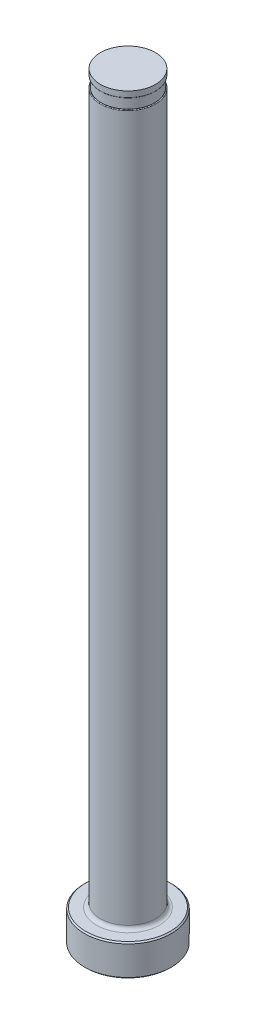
SolidWorks part; units mm, degrees
ref_plane "Front Plane" through (0, 0, 0) normal (0, 0, 1) x (1, 0, 0)
ref_plane "Top Plane" through (0, 0, 0) normal (0, 1, 0) x (1, 0, 0)
ref_plane "Right Plane" through (0, 0, 0) normal (1, 0, 0) x (0, 0, -1)
other "Configuration Table"
sketch "Sketch1" plane through (0, 0, 0) normal (0, 0, 1) x (1, 0, 0)
  line L0 (0, 259.9588) -> (0, -15.1925) construction
  line L1 (0, 0) -> (-8.7249, 0)
  line L2 (-8.7249, 0) -> (-8.7249, 6.35)
  line L3 (-8.7249, 6.35) -> (-5.5562, 6.35)
  line L4 (-5.5562, 6.35) -> (-5.5562, 152.4)
  line L5 (-5.5562, 152.4) -> (0, 152.4)
  line L6 (0, 152.4) -> (0, 0)
  dimension "L" = 152.4
  dimension "H" = 17.4498
  dimension "T" = 6.35
  dimension "D" = 11.1125
revolve "Revolve1" add sketch "Sketch1" angle 360 about L0
chamfer "Chamfer1" distance 0.254 angle 45 2 edges at (0, 6.35, 8.7249) (0, 0, 8.7249)
fillet "Fillet1" radius 0.762 1 edges at (0, 6.35, 5.5562)
sketch "Sketch2" plane through (0, 0, 0) normal (0, 0, 1) x (1, 0, 0)
  line L0 (-5.5562, 152.4) -> (-5.5562, 7.112) construction
  line L1 (-5.5562, 151.13) -> (-5.353, 151.13)
  line L2 (-5.5562, 151.13) -> (-5.5562, 149.098)
  line L3 (-5.5562, 149.098) -> (-5.353, 149.098)
  line L4 (-5.353, 151.13) -> (-5.353, 149.098)
  line L5 (5.5562, 152.4) -> (-5.5562, 152.4) construction
  line L6 (0, 153.4483) -> (0, 147.3282) construction
  dimension "D1" = 2.032
  dimension "N" = 1.27
  dimension "FD" = 0.2032
  dimension "D3" = 10.7061
revolve "Vent Relief" cut sketch "Sketch2" angle 360 about L6
sketch "Sketch3" plane through (0, 0, 0) normal (0, 0, 1) x (1, 0, 0)
  line L0 (-5.353, 150.114) -> (-5.353, 86.614)
  line L1 (-5.353, 151.13) -> (-5.353, 149.098) construction
  line L2 (-5.5562, 149.098) -> (-5.5562, 7.112) construction
  line L3 (-5.5562, 85.4964) -> (-5.5562, 150.114)
  line L4 (-5.5562, 150.114) -> (-5.353, 150.114)
  arc A0 (-5.353, 86.614) -> (-5.5562, 85.4964) centre (-8.528, 86.614) cw
  dimension "D1" = 3.175
  dimension "D2" = 63.5
extrude "D-Slot" cut sketch "Sketch3" against normal through all both and the other way through all
sketch "Sketch5" plane through (0, 0, 0) normal (0, 0, 1) x (1, 0, 0)
  line L0 (-5.5562, 151.13) -> (5.5562, 151.13) construction
  line L1 (-5.5562, 152.4) -> (-5.5372, 152.4)
  line L2 (-5.5562, 152.4) -> (-5.5562, 151.13)
  line L3 (-5.5562, 151.13) -> (-5.5372, 151.13)
  line L4 (-5.5372, 152.4) -> (-5.5372, 151.13)
  line L5 (0, 152.6877) -> (0, 150.5771) construction
  dimension "VP" = 0.019
revolve "Vent Diameter" cut sketch "Sketch5" angle 360 about L5
fillet "Fillet2" radius 0.127 2 edges at (5.5562, 149.098, 0) (0, 151.13, 5.5372)
sketch "Pocket Sketch" plane through (0, 0, 0) normal (0, 0, 1) x (1, 0, 0)
  line L0 (-9.1218, 0) -> (-9.1218, 6.3754)
  line L1 (-9.1218, 6.3754) -> (-6.5167, 6.3754)
  line L2 (-5.7547, 7.1374) -> (-5.7547, 22.225)
  line L3 (-5.7547, 22.225) -> (0, 22.225)
  line L4 (0, 22.225) -> (0, 0)
  line L5 (0, 0) -> (-9.1218, 0)
  line L6 (0, 12.6104) -> (0, -2.4989) construction
  line L7 (-8.7249, 6.096) -> (-8.7249, 0.254) construction
  line L8 (8.4709, 6.35) -> (-8.4709, 6.35) construction
  line L9 (-5.5562, 85.4964) -> (-5.5562, 7.112) construction
  line L10 (-6.5167, 6.3754) -> (-5.7547, 7.1374)
  point P3 (-5.7547, 6.3754)
  dimension "D1" = 18.2435
  dimension "D2" = 0.3969
  dimension "D3" = 0.0254
  dimension "D4" = 0.1984
  dimension "D5" = 11.5094
  dimension "D6" = 22.225
